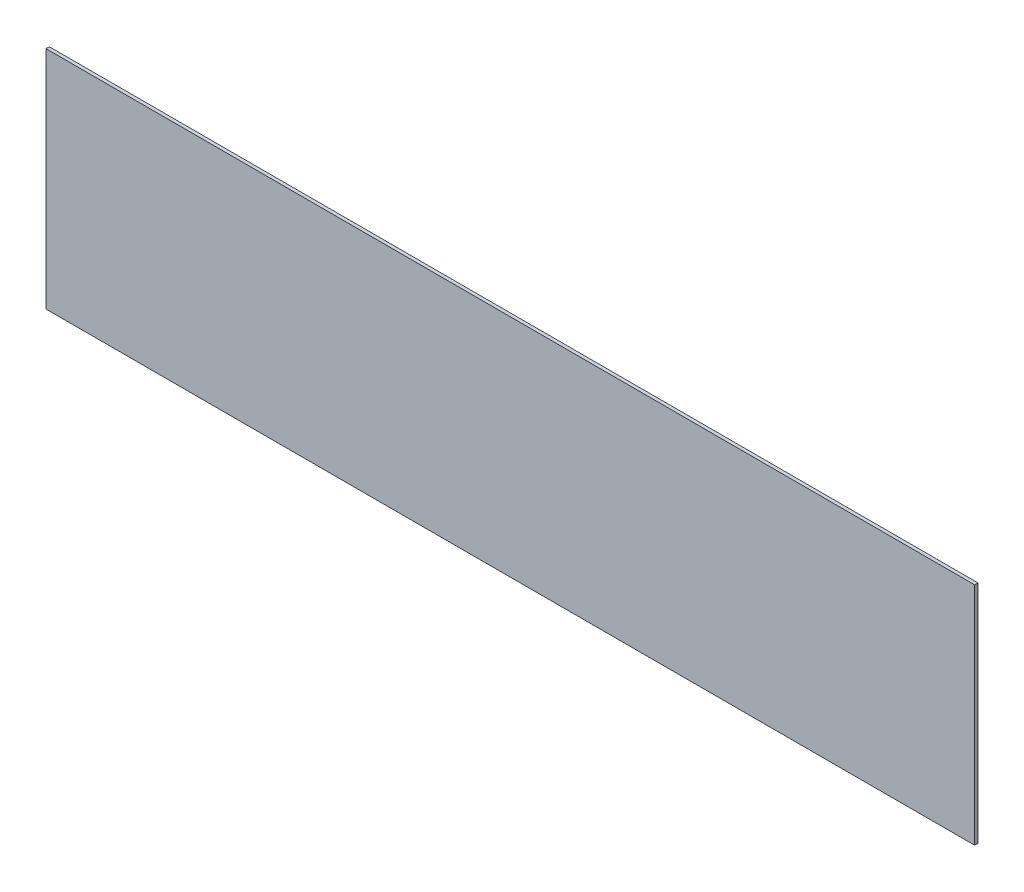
SolidWorks part; units mm, degrees
ref_plane "Front Plane" through (0, 0, 0) normal (0, 0, 1) x (1, 0, 0)
ref_plane "Top Plane" through (0, 0, 0) normal (0, 1, 0) x (1, 0, 0)
ref_plane "Right Plane" through (0, 0, 0) normal (1, 0, 0) x (0, 0, -1)
sketch "Sketch2" plane through (0, 0, 0) normal (0, 0, 1) x (1, 0, 0)
  line L1 (-799.0541, 114.1506) -> (978.9459, 114.1506)
  line L2 (-799.0541, 114.1506) -> (-799.0541, 545.9506)
  line L3 (-799.0541, 545.9506) -> (978.9459, 545.9506)
  line L4 (978.9459, 114.1506) -> (978.9459, 545.9506)
  dimension "D1" = 1778
  dimension "D2" = 431.8
extrude "Boss-Extrude1" add sketch "Sketch2" along normal blind 6.35
